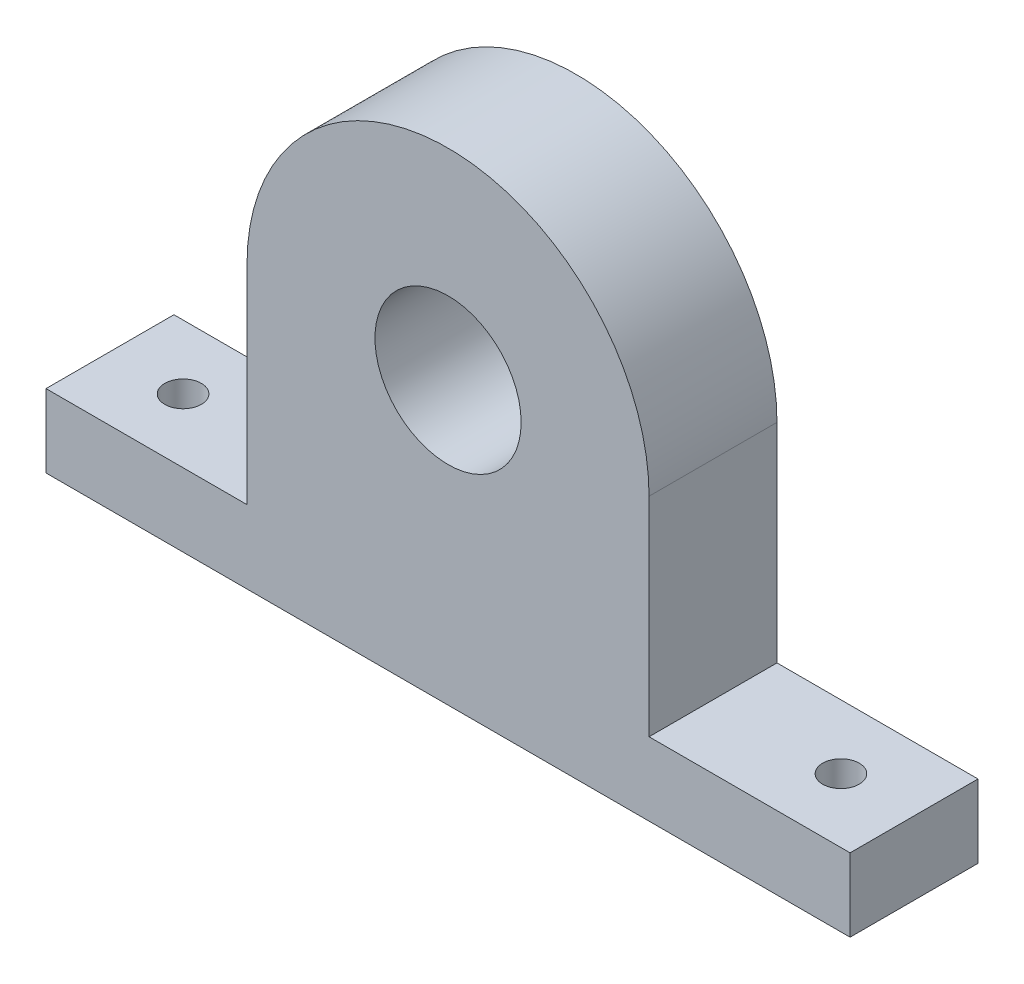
SolidWorks part; units mm, degrees
ref_plane "前视基准面" through (0, 0, 0) normal (0, 0, 1) x (1, 0, 0)
ref_plane "上视基准面" through (0, 0, 0) normal (0, 1, 0) x (1, 0, 0)
ref_plane "右视基准面" through (0, 0, 0) normal (1, 0, 0) x (0, 0, -1)
sketch "草图1" plane through (0, 0, 0) normal (0, 0, 1) x (1, 0, 0)
  line L0 (-110, -57) -> (110, -57)
  line L1 (-55, 0) -> (-55, -57)
  line L2 (55, 0) -> (55, -57)
  line L3 (-110, -57) -> (-110, -77)
  line L4 (-110, -77) -> (110, -77)
  line L5 (110, -77) -> (110, -57)
  arc A0 (55, 0) -> (-55, 0) centre (0, 0) ccw
  dimension "D1" = 110
  dimension "D2" = 57
  dimension "D3" = 20
  dimension "D4" = 110
  dimension "D5" = 220
extrude "拉伸1" add sketch "草图1" along normal mid plane 35
sketch "草图2" plane through (0, -77, 0) normal (0, -1, 0) x (1, 0, 0)
  line L0 (134.4719, 0) -> (-144.3596, 0) construction
  circle A0 centre (90, 0) radius 5
  circle A1 centre (-90, 0) radius 5
  dimension "D1" = 180
  dimension "D2" = 90
  dimension "D3" = 10
  dimension "D4" = 10
extrude "切除-拉伸1" cut sketch "草图2" against normal blind 35
sketch "草图3" plane through (0, 0, 17.5) normal (0, 0, 1) x (1, 0, 0)
  circle A0 centre (0, 0) radius 20
  dimension "D1" = 40
extrude "切除-拉伸2" cut sketch "草图3" against normal blind 35
